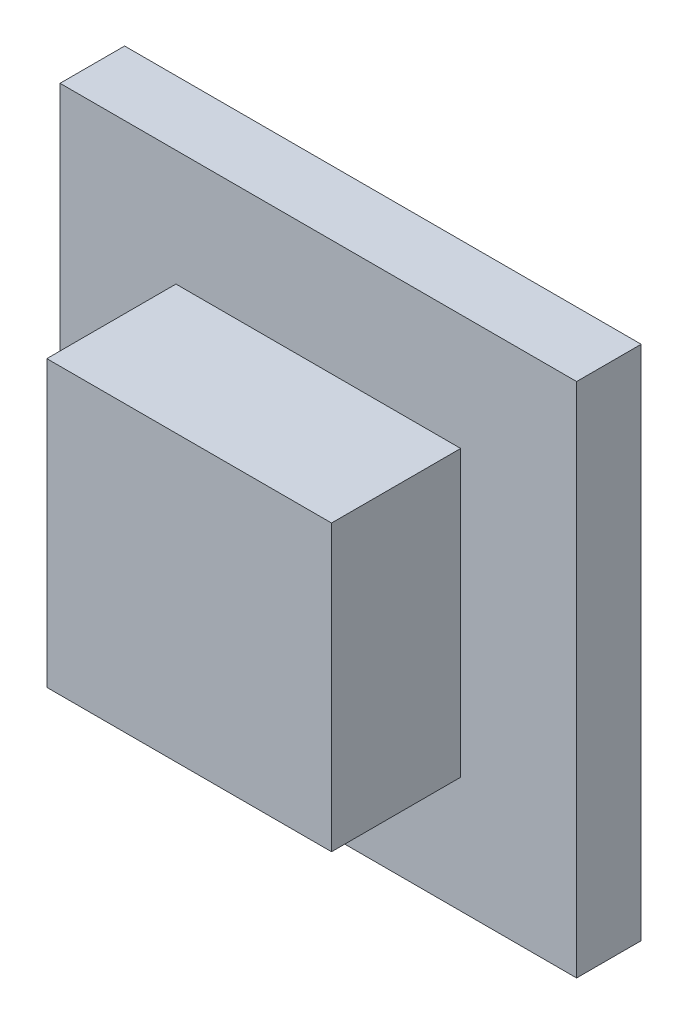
SolidWorks part; units mm, degrees
ref_plane "Front Plane" through (0, 0, 0) normal (0, 0, 1) x (1, 0, 0)
ref_plane "Top Plane" through (0, 0, 0) normal (0, 1, 0) x (1, 0, 0)
ref_plane "Right Plane" through (0, 0, 0) normal (1, 0, 0) x (0, 0, -1)
sketch "Sketch1" plane through (0, 0, 0) normal (0, 0, 1) x (1, 0, 0)
  line L1 (3.175, -3.175) -> (-3.175, -3.175)
  line L2 (3.175, -3.175) -> (3.175, 3.175)
  line L3 (3.175, 3.175) -> (-3.175, 3.175)
  line L4 (-3.175, -3.175) -> (-3.175, 3.175)
  line L5 (3.175, -3.175) -> (-3.175, 3.175) construction
  line L6 (3.175, 3.175) -> (-3.175, -3.175) construction
  point P0 (0, 0)
  dimension "D1" = 6.35
extrude "Boss-Extrude1" add sketch "Sketch1" against normal blind 0.7937
sketch "Sketch2" plane through (0, 0, 0) normal (0, 0, 1) x (1, 0, 0)
  line L1 (-1.75, -1.75) -> (1.75, -1.75)
  line L2 (-1.75, -1.75) -> (-1.75, 1.75)
  line L3 (-1.75, 1.75) -> (1.75, 1.75)
  line L4 (1.75, -1.75) -> (1.75, 1.75)
  line L5 (-1.75, -1.75) -> (1.75, 1.75) construction
  line L6 (-1.75, 1.75) -> (1.75, -1.75) construction
  point P0 (0, 0)
  dimension "D1" = 3.5
extrude "Boss-Extrude2" add sketch "Sketch2" along normal blind 1.5875
